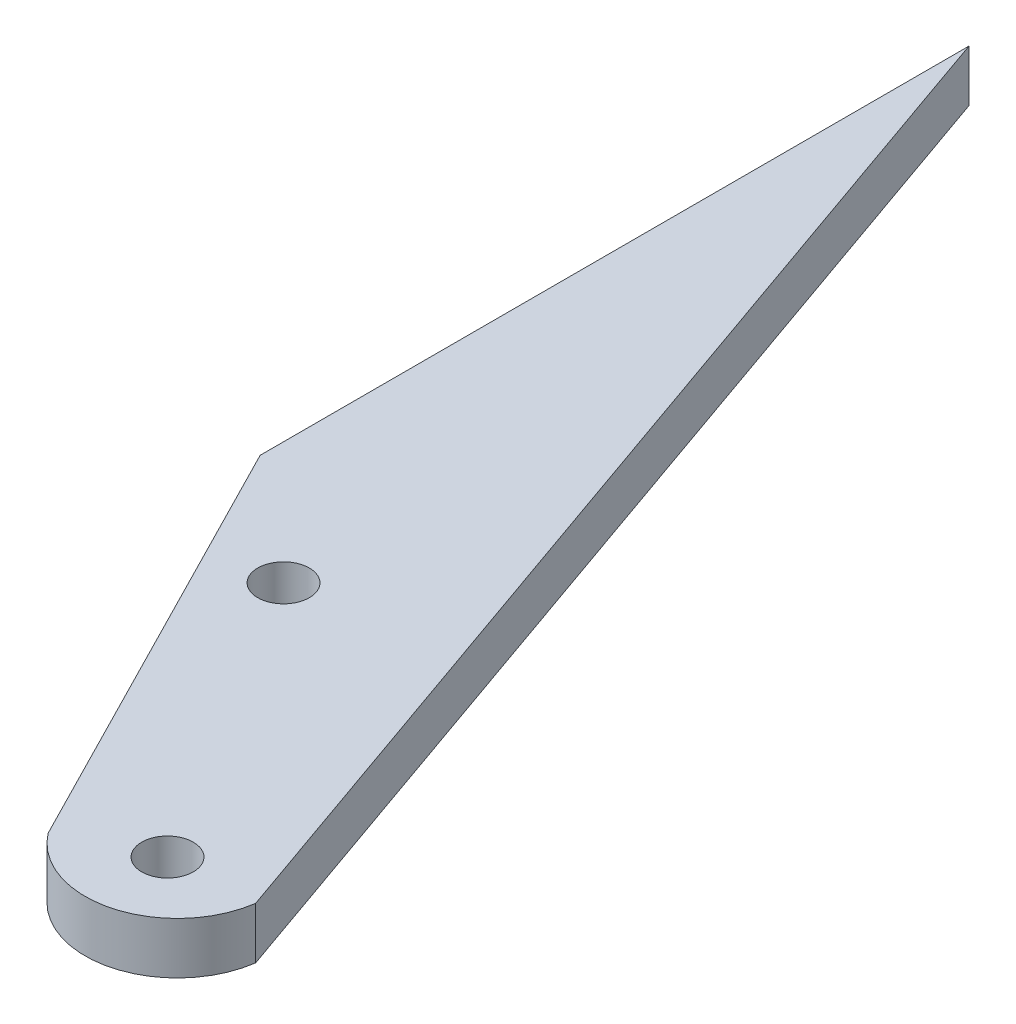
SolidWorks part; units mm, degrees
ref_plane "Front Plane" through (0, 0, 0) normal (0, 0, 1) x (1, 0, 0)
ref_plane "Top Plane" through (0, 0, 0) normal (0, 1, 0) x (1, 0, 0)
ref_plane "Right Plane" through (0, 0, 0) normal (1, 0, 0) x (0, 0, -1)
sketch "Sketch1" plane through (0, 0, 0) normal (0, 1, 0) x (1, 0, 0)
  line L0 (-22.4436, 63.9457) -> (-22.4436, 22.7057)
  line L1 (-22.4436, 63.9457) -> (0, 0)
  line L2 (-22.4436, 22.7057) -> (-9.5737, -2.4985)
  line L3 (-22.4436, 22.7057) -> (-15.3365, 16.9587) construction
  line L4 (-15.3365, 16.9587) -> (-4.8979, -0.2299) construction
  arc A0 (-9.5737, -2.4985) -> (0, 0) centre (-5.3082, 0.7483) ccw
  circle A2 centre (-15.3365, 16.9587) radius 1.5
  circle A3 centre (-4.8979, -0.2299) radius 1.5
  dimension "D1" = 67.77
  dimension "D2" = 128.96
  dimension "D8" = 160.23
  dimension "D10" = 3
  dimension "D11" = 3
  dimension "D3" = 41.24
  dimension "D4" = 19.34
  dimension "D5" = 28.3
  dimension "D6" = 152.95
  dimension "D7" = 9.14
  dimension "D9" = 20.11
extrude "Boss-Extrude1" add sketch "Sketch1" along normal blind 3
